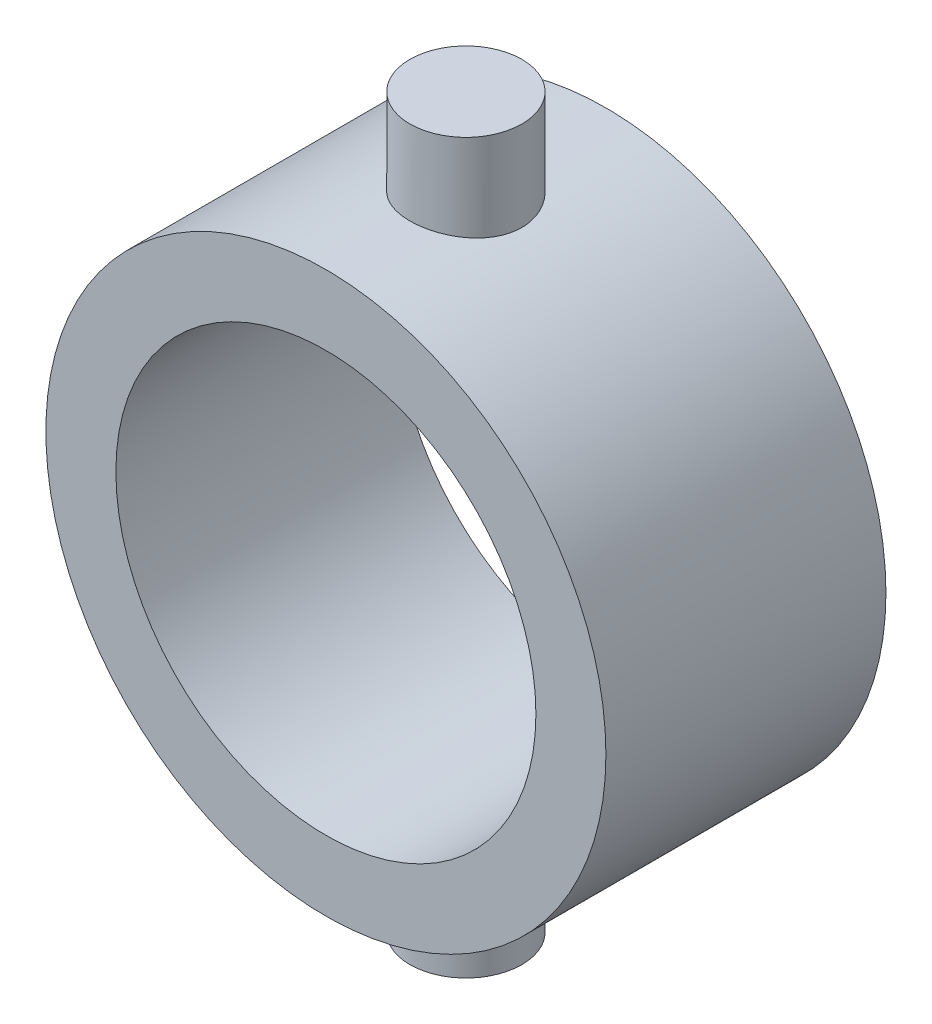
SolidWorks part; units mm, degrees
ref_plane "Front Plane" through (0, 0, 0) normal (0, 0, 1) x (1, 0, 0)
ref_plane "Top Plane" through (0, 0, 0) normal (0, 1, 0) x (1, 0, 0)
ref_plane "Right Plane" through (0, 0, 0) normal (1, 0, 0) x (0, 0, -1)
sketch "Sketch2" plane through (0, 0, 0) normal (0, 0, 1) x (1, 0, 0)
  circle A0 centre (0, 0) radius 10
  dimension "D1" = 20
extrude "Boss-Extrude1" add sketch "Sketch2" along normal blind 10
sketch "Sketch3" plane through (0, 0, 10) normal (0, 0, 1) x (1, 0, 0)
  circle A0 centre (0, 0) radius 7.5
  dimension "D1" = 15
extrude "Cut-Extrude1" cut sketch "Sketch3" against normal blind 20
sketch "Sketch4" plane through (0, 0, 0) normal (0, 1, 0) x (1, 0, 0)
  circle A0 centre (0, -5) radius 2
  dimension "D1" = 4
  dimension "D2" = 5
extrude "Boss-Extrude2" add sketch "Sketch4" along normal mid plane 26
sketch "Sketch5" plane through (0, 0, 10) normal (0, 0, 1) x (1, 0, 0)
  circle A0 centre (0, 0) radius 7.5 construction
  circle A1 centre (0, 0) radius 7.5
extrude "Cut-Extrude2" cut sketch "Sketch5" against normal blind 30
